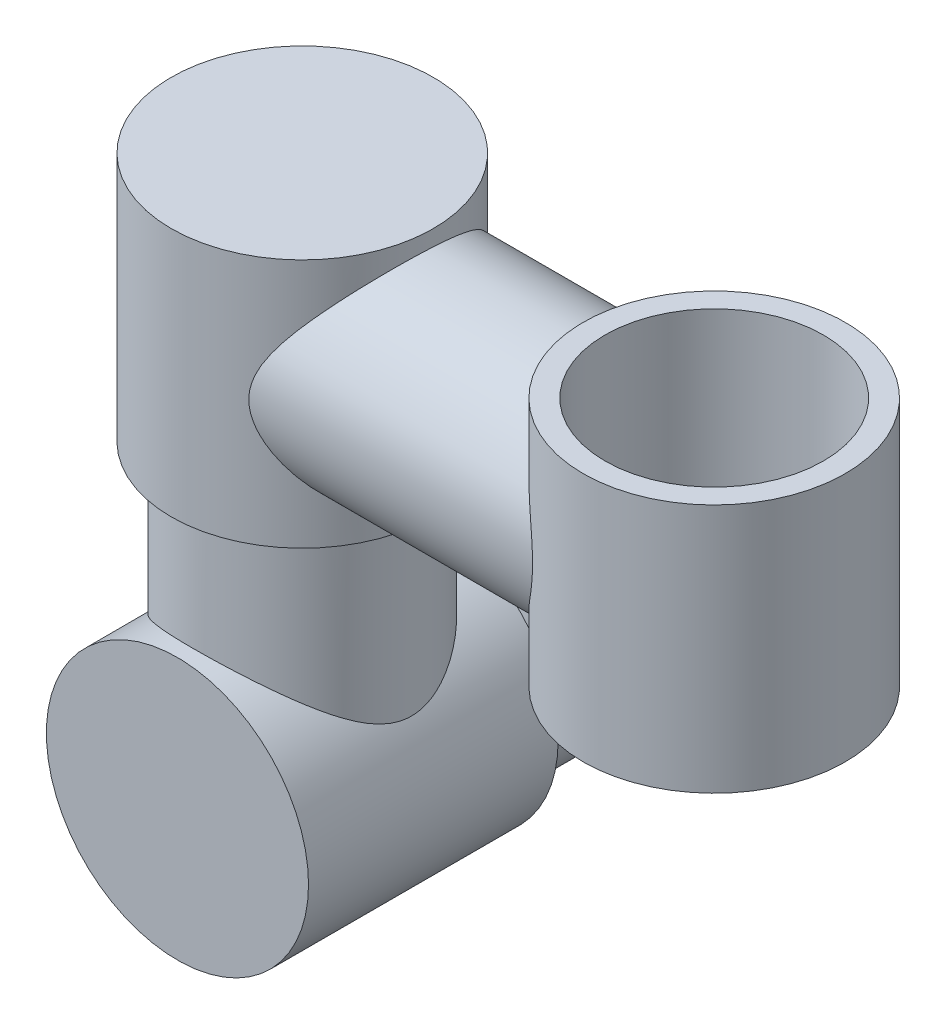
SolidWorks part; units mm, degrees
ref_plane "Front Plane" through (0, 0, 0) normal (0, 0, 1) x (1, 0, 0)
ref_plane "Top Plane" through (0, 0, 0) normal (0, 1, 0) x (1, 0, 0)
ref_plane "Right Plane" through (0, 0, 0) normal (1, 0, 0) x (0, 0, -1)
sketch "Sketch3" plane through (0, 0, 0) normal (0, 0, 1) x (1, 0, 0)
  circle A1 centre (0, 0) radius 210
extrude "Boss-Extrude3" add sketch "Sketch3" along normal blind 400
sketch "Sketch5" plane through (0, 0, 0) normal (0, 0, 1) x (1, 0, 0)
  circle A0 centre (0, 0) radius 175
extrude "Boss-Extrude4" add sketch "Sketch5" against normal blind 250
sketch "Sketch7" plane through (0, 0, 0) normal (0, 1, 0) x (1, 0, 0)
  line L0 (0, -368.5) -> (0, 368.5) construction
  line L2 (-561, 0) -> (561, 0) construction
  circle A0 centre (0, -200) radius 175
extrude "Boss-Extrude5" add sketch "Sketch7" along normal blind 410
sketch "Sketch10" plane through (0, 410, 0) normal (0, 1, 0) x (1, 0, 0)
  circle A0 centre (0, -200) radius 210
  point P0 (0, -200)
extrude "Boss-Extrude6" add sketch "Sketch10" along normal blind 400
sketch "Sketch11" plane through (0, 0, 0) normal (1, 0, 0) x (0, 0, -1)
  line L1 (0, 561) -> (0, -561) construction
  line L2 (368.5, 0) -> (-368.5, 0) construction
  circle A0 centre (-210, 610) radius 175
extrude "Boss-Extrude7" add sketch "Sketch11" along normal blind 620
ref_plane "Plane1" through (0, 610, 0) normal (0, 1, 0) x (1, 0, 0)
sketch "Sketch12" plane through (0, 610, 0) normal (0, 1, 0) x (1, 0, 0)
  line L0 (0, -368.5) -> (0, 368.5) construction
  line L1 (-561, 0) -> (561, 0) construction
  circle A0 centre (670, -210) radius 210
extrude "Boss-Extrude8" add sketch "Sketch12" along normal mid plane 400
sketch "Sketch13" plane through (0, 810, 0) normal (0, 1, 0) x (1, 0, 0)
  circle A0 centre (670, -210) radius 175
extrude "Cut-Extrude1" cut sketch "Sketch13" against normal blind 250
equation "\"connector1_l\"= 250"
equation "\"connector1_d\"= 350"
equation "\"connector2_l\"= 220"
equation "\"connector2_d\"= 280"
equation "\"member1_d\"= 350"
equation "\"member2_d\"= 280"
equation "\"D1@Boss-Extrude3\"=\"end_l\""
equation "\"D1@Sketch5\"=\"connector1_d\""
equation "\"D1@Boss-Extrude4\"=\"connector1_l\""
equation "\"D1@Sketch7\"=\"member1_d\""
equation "\"D2@Sketch7\"=\"end_l\"/2"
equation "\"D1@Boss-Extrude6\"=\"end_l\""
equation "\"D1@Sketch11\"=\"member1_d\""
equation "\"D3@Sketch11\"=\"end_d\" / 2"
equation "\"D1@Boss-Extrude5\" = \"end_d\" / 2 + \"p1_m1_l\""
equation "\"D4@Sketch3\"=\"end_d\""
equation "\"D2@Sketch11\"=\"p1_m1_l\" +\"end_l\"/2 +\"end_d\"/2"
equation "\"D3@Sketch10\"=\"end_d\""
equation "\"D1@Boss-Extrude7\"=\"end_d\"+200"
equation "\"D1@Plane1\"=\"end_l\"/2 + \"end_d\"/2 + \"p1_m1_l\""
equation "\"D1@Sketch12\"=\"end_d\""
equation "\"D2@Sketch12\" = \"end_d\" + \"p1_m2_l\""
equation "\"D3@Sketch12\"=\"end_d\"/2"
equation "\"D1@Boss-Extrude8\"=\"end_l\""
equation "\"D1@Sketch13\"=\"connector1_d\""
equation "\"D1@Cut-Extrude1\"=\"connector1_l\""
equation "\"end_l\" = 400"
equation "\"end_d\" = 420"
equation "\"p1_m2_l\" = 250"
equation "\"p1_m1_l\" = 200"
